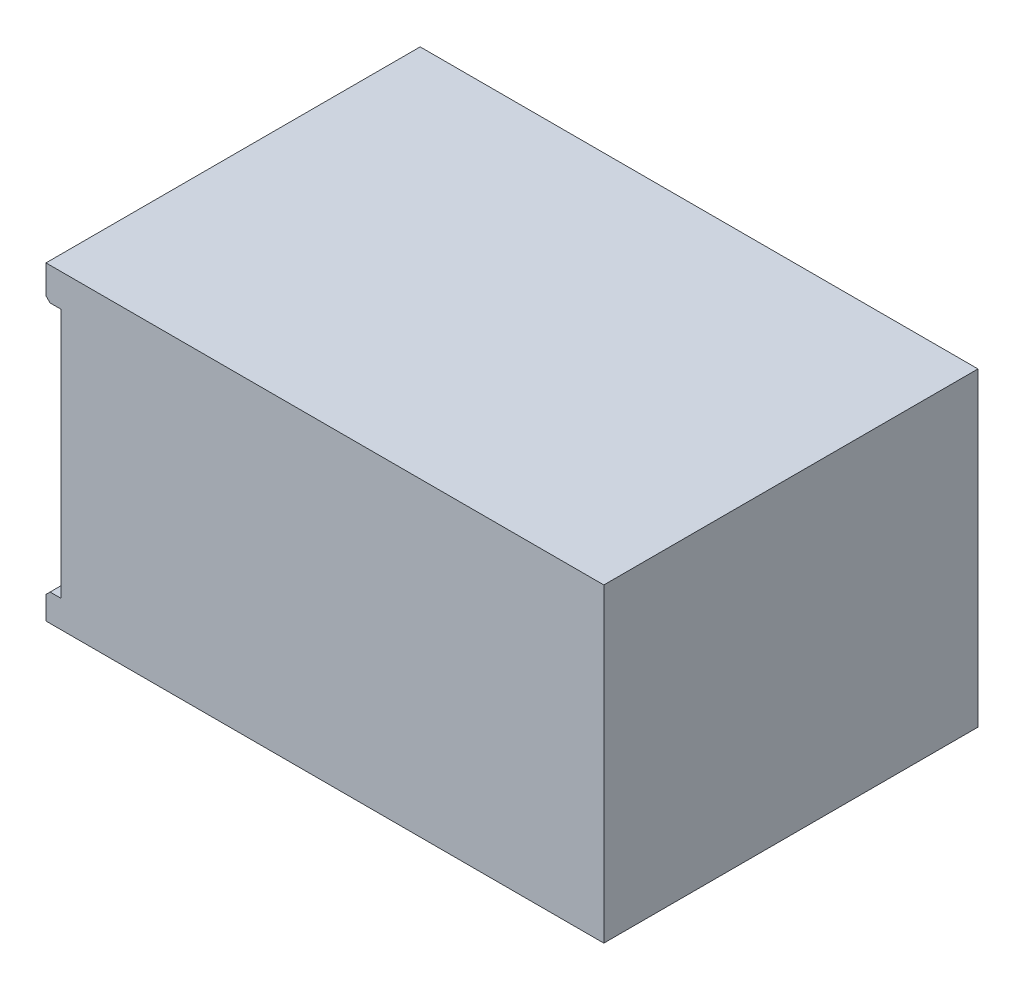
SolidWorks part; units mm, degrees
ref_plane "FRONT" through (0, 0, 0) normal (0, 0, 1) x (1, 0, 0)
ref_plane "TOP" through (0, 0, 0) normal (0, 1, 0) x (1, 0, 0)
ref_plane "RIGHT" through (0, 0, 0) normal (1, 0, 0) x (0, 0, -1)
sketch "Sketch1" plane through (0, 0, 0) normal (0, 0, 1) x (1, 0, 0)
  line L0 (50.673, 0) -> (50.673, -28.956)
  line L1 (50.673, -28.956) -> (-1.397, -28.956)
  line L2 (-1.397, -28.956) -> (-1.397, -26.416)
  line L3 (-1.397, -26.416) -> (0, -26.416)
  line L4 (0, -26.416) -> (0, -3.048)
  line L5 (0, -3.048) -> (-1.397, -3.048)
  line L6 (-1.397, -3.048) -> (-1.397, 0)
  line L7 (-1.397, 0) -> (50.673, 0)
  dimension "D1" = 52.07
  dimension "D2" = 50.673
  dimension "D3" = 3.048
  dimension "D4" = 2.54
  dimension "D5" = 28.956
extrude "Extrude1" add sketch "Sketch1" along normal mid plane 34.925
sketch "Sketch2" plane through (0, 0, 0) normal (-1, 0, 0) x (0, 0, 1)
  line L0 (0, 0) -> (0, -28.956) construction
  line L1 (17.4625, -28.956) -> (-17.4625, -28.956) construction
  line L2 (0, -14.478) -> (21.0733, -14.478) construction
  point P0 (-13.97, -22.86)
  point P1 (13.97, -6.096)
  dimension "D1" = 13.97
  dimension "D2" = 13.97
  dimension "D3" = 8.382
  dimension "D4" = 8.382
hole_wizard "#6-32 Tapped Hole1" positions "3DSketch1" profile "Sketch3" tap size "#6-32" standard "Ansi Inch"
sketch3d "3DSketch1"
  point P0 (0, -22.86, -13.97)
  point P3 (0, -6.096, 13.97)
sketch "Sketch3" plane through (0, -22.86, -13.97) normal (0, 1, 0) x (0, 0, 1)
  line L0 (0, 0) -> (0, 10.8101)
  line L1 (0, 10.8101) -> (1.3525, 9.9974)
  line L2 (1.3525, 9.9974) -> (1.3525, 7.62)
  line L3 (1.3525, 7.62) -> (1.7526, 7.62)
  line L4 (1.7526, 7.62) -> (1.7526, 0)
  line L5 (1.7526, 0) -> (0, 0)
  line L10 (0, 10.8101) -> (-1.3526, 9.9974) construction
  line L11 (0, -6.35) -> (0, 107.95) construction
  dimension "Tap Drill Dia." = 2.7051
  dimension "Tap Drill Depth" = 9.9974
  dimension "Thread Major Dia." = 3.5052
  dimension "Thread Depth" = 7.62
  dimension "Drill Angle" = 118
chamfer "Chamfer1" distance 0.381 angle 45 2 edges at (-1.397, -26.416, 0) (-1.397, -3.048, 0)
